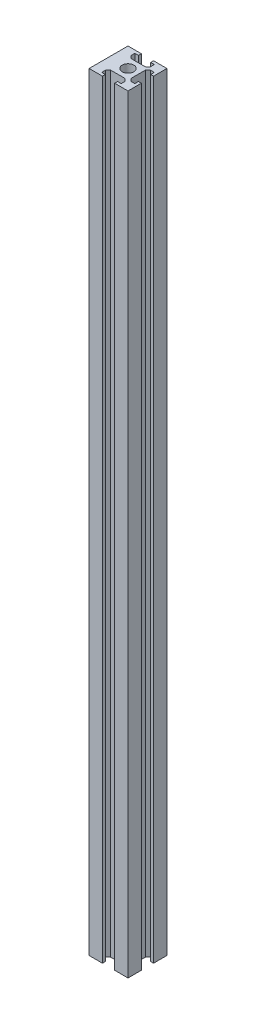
SolidWorks part; units mm, degrees
ref_plane "Ebene vorne" through (0, 0, 0) normal (0, 0, 1) x (1, 0, 0)
ref_plane "Ebene oben" through (0, 0, 0) normal (0, 1, 0) x (1, 0, 0)
ref_plane "Ebene rechts" through (0, 0, 0) normal (1, 0, 0) x (0, 0, -1)
sketch "Skizze1" plane through (0, 0, 0) normal (0, 1, 0) x (1, 0, 0)
  line L0 (0, 54.0679) -> (0, -54.0679) construction
  line L1 (-53.0666, 0) -> (53.0666, 0) construction
  line L2 (-3.125, 10) -> (-3.125, 8.5)
  line L3 (-10, 10) -> (-3.125, 10)
  line L4 (-10, 10) -> (-10, -10)
  line L5 (-10, -10) -> (-3.125, -10)
  line L6 (10, 10) -> (10, 3.125)
  line L7 (-3.125, 8.5) -> (-5, 8.5)
  line L8 (-5, 8.5) -> (-5, 6.5048)
  line L9 (-5, 6.5048) -> (-3.7072, 5.2)
  line L10 (-3.7072, 5.2) -> (3.7072, 5.2)
  line L11 (5, 6.5048) -> (3.7072, 5.2)
  line L12 (5, 8.5) -> (5, 6.5048)
  line L13 (3.125, 8.5) -> (5, 8.5)
  line L14 (3.125, 10) -> (3.125, 8.5)
  line L15 (10, 3.125) -> (8.5, 3.125)
  line L16 (8.5, 3.125) -> (8.5, 5)
  line L17 (8.5, 5) -> (6.5048, 5)
  line L18 (6.5048, 5) -> (5.2, 3.7072)
  line L19 (5.2, 3.7072) -> (5.2, -3.7072)
  line L20 (6.5048, -5) -> (5.2, -3.7072)
  line L21 (8.5, -5) -> (6.5048, -5)
  line L22 (8.5, -3.125) -> (8.5, -5)
  line L23 (10, -3.125) -> (8.5, -3.125)
  line L24 (54.0679, 0) -> (-54.0679, 0) construction
  line L25 (3.125, -10) -> (3.125, -8.5)
  line L26 (3.125, -8.5) -> (5, -8.5)
  line L27 (5, -8.5) -> (5, -6.5048)
  line L28 (5, -6.5048) -> (3.7072, -5.2)
  line L29 (3.7072, -5.2) -> (-3.7072, -5.2)
  line L30 (-5, -6.5048) -> (-3.7072, -5.2)
  line L31 (-5, -8.5) -> (-5, -6.5048)
  line L32 (-3.125, -8.5) -> (-5, -8.5)
  line L33 (-3.125, -10) -> (-3.125, -8.5)
  line L34 (0, -54.0679) -> (0, 54.0679) construction
  line L35 (3.125, 10) -> (10, 10)
  line L36 (10, -3.125) -> (10, -10)
  line L37 (3.125, -10) -> (10, -10)
  circle A0 centre (0, 0) radius 3
  point P19 (0, 5.2)
  point P34 (5.2, 0)
  point P47 (0, -5.2)
  point P51 (0, 0)
  dimension "D3" = 6
  dimension "D1" = 20
  dimension "D2" = 20
  dimension "D4" = 1.5
  dimension "D5" = 10
  dimension "D6" = 6.25
  dimension "D7" = 4.8
  dimension "D8" = 3
extrude "Aufsatz-Linear austragen1" add sketch "Skizze1" along normal blind 395
